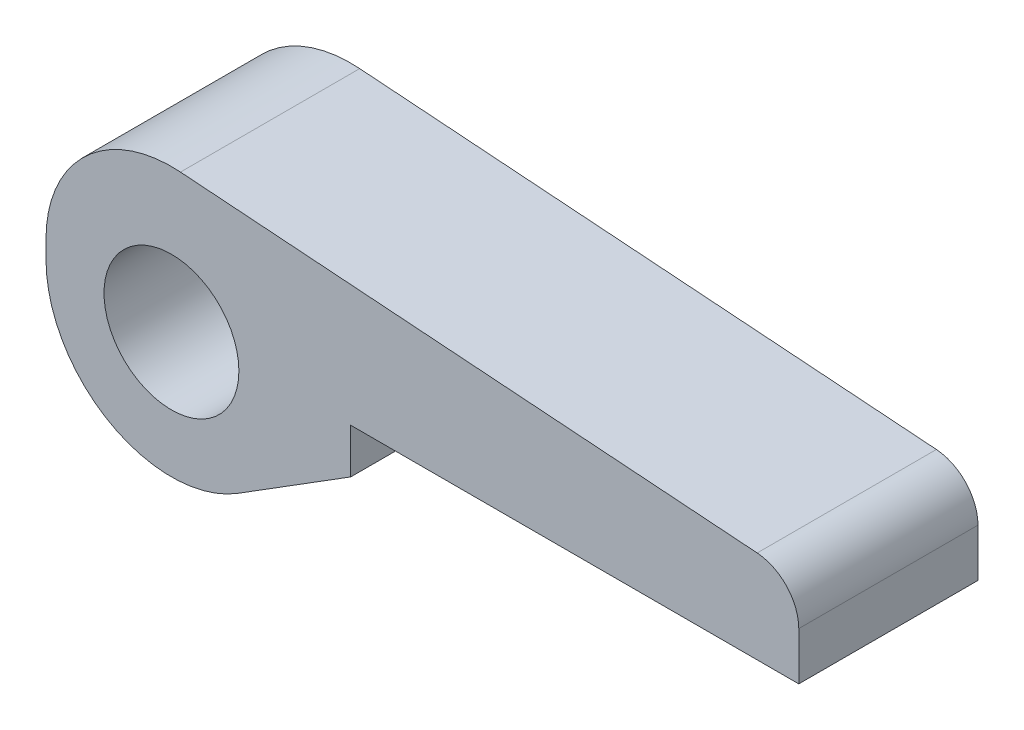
SolidWorks part; units mm, degrees
ref_plane "Plan de face" through (0, 0, 0) normal (0, 0, 1) x (1, 0, 0)
ref_plane "Plan de dessus" through (0, 0, 0) normal (0, 1, 0) x (1, 0, 0)
ref_plane "Plan de droite" through (0, 0, 0) normal (1, 0, 0) x (0, 0, -1)
sketch "Esquisse1" plane through (0, 0, 0) normal (0, 0, 1) x (1, 0, 0)
  line L0 (0, -25.1442) -> (0, 49.3432) construction
  line L1 (0, 0) -> (192.2002, 0) construction
  line L2 (40, 0) -> (40, 2)
  line L3 (40, 2) -> (140, 2)
  line L4 (140, 2) -> (140, 12.6936)
  line L5 (-28, 0) -> (-28, 4)
  line L6 (2.0093, 31.9278) -> (130.7176, 22.6678)
  line L7 (40, 0) -> (40, -8)
  line L8 (40, -8) -> (14.8528, -23.7359)
  circle A0 centre (0, 0) radius 15.05
  arc A1 (-28, 0) -> (14.8528, -23.7359) centre (0, 0) ccw
  arc A2 (-28, 4) -> (2.0093, 31.9278) centre (0, 4) cw
  arc A3 (140, 12.6936) -> (130.7176, 22.6678) centre (130, 12.6936) ccw
  point P17 (140, 22)
  dimension "D3" = 30.1
  dimension "D4" = 28
  dimension "D8" = 10
  dimension "D1" = 4
  dimension "D2" = 40
  dimension "D5" = 4
  dimension "D6" = 20
  dimension "D7" = 100
  dimension "D9" = 8
extrude "Extrusion1" add sketch "Esquisse1" along normal blind 40
